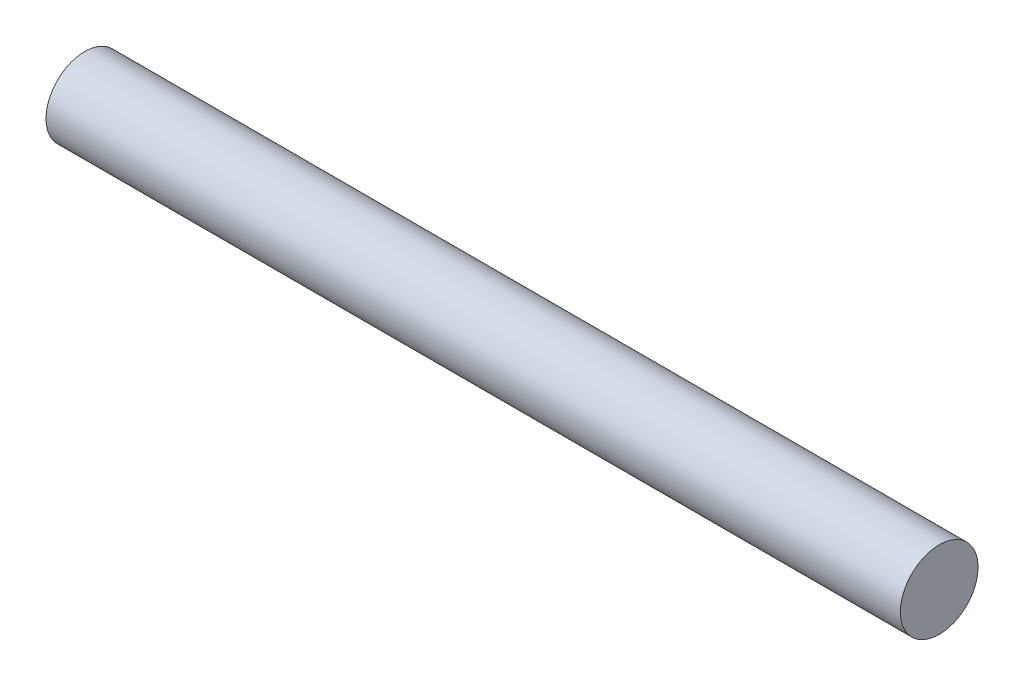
SolidWorks part; units mm, degrees
ref_plane "Face" through (0, 0, 0) normal (0, 0, 1) x (1, 0, 0)
ref_plane "Dessus" through (0, 0, 0) normal (0, 1, 0) x (1, 0, 0)
ref_plane "Droite" through (0, 0, 0) normal (1, 0, 0) x (0, 0, -1)
sketch "Esquisse1" plane through (0, 0, 0) normal (0, 0, 1) x (1, 0, 0)
  line L0 (-17, 4) -> (-17, -1)
  line L3 (-17, 4) -> (93, 4)
  line L4 (93, 4) -> (93, -1)
  line L5 (-17, -1) -> (93, -1)
  line L6 (-40, -1) -> (100, -1) construction
  dimension "D1" = 110
  dimension "D3" = 5
revolve "Base-Révolution" add sketch "Esquisse1" angle 360 about L6
